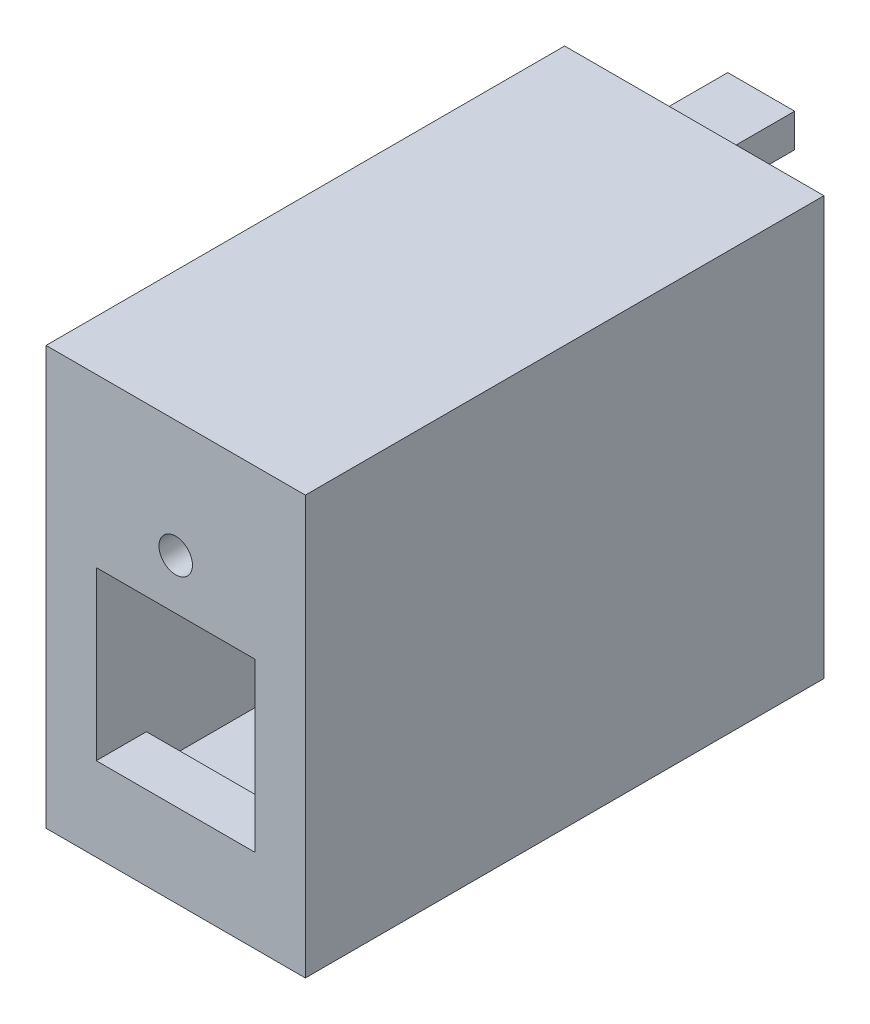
SolidWorks part; units mm, degrees
ref_plane "Front Plane" through (0, 0, 0) normal (0, 0, 1) x (1, 0, 0)
ref_plane "Top Plane" through (0, 0, 0) normal (0, 1, 0) x (1, 0, 0)
ref_plane "Right Plane" through (0, 0, 0) normal (1, 0, 0) x (0, 0, -1)
sketch "Sketch1" plane through (0, 0, 0) normal (0, 0, 1) x (1, 0, 0)
  line L0 (102.5, -60) -> (102.5, 60) construction
  line L1 (87, 12.5) -> (102.5, 12.5)
  line L2 (87, 12.5) -> (87, -12.5)
  line L3 (87, -12.5) -> (102.5, -12.5)
  line L4 (102.5, 12.5) -> (102.5, -12.5)
  line L5 (87, 12.5) -> (102.5, -12.5) construction
  line L6 (87, -12.5) -> (102.5, 12.5) construction
  line L8 (90, 45) -> (90, -45) construction
  point P0 (94.75, 0)
  point P9 (102.5, 0)
  dimension "D1" = 25
  dimension "D2" = 3
extrude "Boss-Extrude1" add sketch "Sketch1" along normal offset from surface (31 mm away) 3
shell "Shell1" thickness 3
sketch "Sketch2" plane through (0, 0, 31) normal (0, 0, 1) x (1, 0, 0)
  line L2 (87, -12.5) -> (102.5, -12.5) construction
  line L6 (99.5, 2.5) -> (90, 2.5)
  line L7 (102.5, 12.5) -> (87, 12.5) construction
  line L9 (90, 12.5) -> (90, -9.5)
  line L10 (90, -9.5) -> (99.5, -9.5)
  line L11 (99.5, -9.5) -> (99.5, 12.5)
  line L12 (90, 2.5) -> (90, -7.5)
  line L13 (90, -7.5) -> (99.5, -7.5)
  line L14 (99.5, -7.5) -> (99.5, 2.5)
  dimension "D2" = 10
  dimension "D3" = 5
  dimension "D1" = 3
extrude "Cut-Extrude1" cut sketch "Sketch2" against normal up to next
sketch "Sketch3" plane through (0, 0, 31) normal (0, 0, 1) x (1, 0, 0)
  line L0 (102.5, 12.5) -> (87, 12.5) construction
  line L1 (99.5, 2.5) -> (90, 2.5) construction
  circle A0 centre (94.75, 5.5) radius 1
  point P4 (94.75, 12.5)
  dimension "D1" = 2
  dimension "D2" = 3
extrude "Cut-Extrude2" cut sketch "Sketch3" against normal up to next
sketch "Sketch4" plane through (0, 0, 0) normal (0, 0, -1) x (-1, 0, 0)
  line L1 (-96.75, 12) -> (-92.75, 12)
  line L2 (-96.75, 12) -> (-96.75, 10)
  line L3 (-96.75, 10) -> (-92.75, 10)
  line L4 (-92.75, 12) -> (-92.75, 10)
  line L7 (-99.5, 9.5) -> (-90, 9.5) construction
  line L8 (-94.75, 9.5) -> (-94.75, 12) construction
  point P7 (-94.75, 10)
  dimension "D1" = 4
  dimension "D2" = 2
  dimension "D3" = 0.5
extrude "Boss-Extrude2" add sketch "Sketch4" along normal blind 4
mirror "Mirror1" about plane through (0, 0, 0) normal (0, 1, 0) of "Boss-Extrude2"
